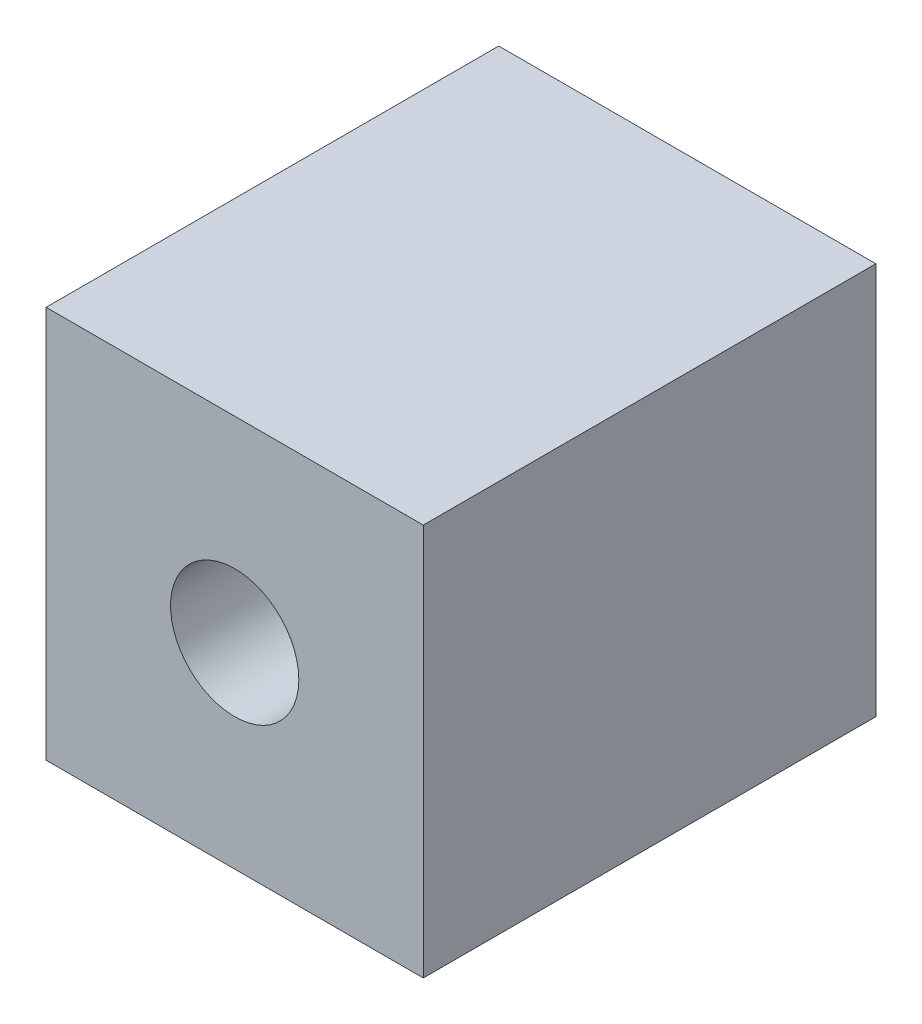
SolidWorks part; units mm, degrees
ref_plane "Plan de face" through (0, 0, 0) normal (0, 0, 1) x (1, 0, 0)
ref_plane "Plan de dessus" through (0, 0, 0) normal (0, 1, 0) x (1, 0, 0)
ref_plane "Plan de droite" through (0, 0, 0) normal (1, 0, 0) x (0, 0, -1)
sketch "Esquisse1" plane through (0, 0, 0) normal (0, 0, 1) x (1, 0, 0)
  line L1 (0, 0) -> (25, 0)
  line L2 (0, 0) -> (0, 26)
  line L3 (0, 26) -> (25, 26)
  line L4 (25, 0) -> (25, 26)
  dimension "D1" = 25
  dimension "D2" = 26
extrude "Extrusion1" add sketch "Esquisse1" along normal blind 30
hole_wizard "Trou taraudé M10x1.51" positions "Esquisse3" profile "Esquisse2" tap size "M10x1.5" standard "ISO"
sketch "Esquisse3" plane through (0, 0, 30) normal (0, 0, 1) x (1, 0, 0)
  line L0 (25, 0) -> (25, 26) construction
  line L1 (25, 26) -> (0, 26) construction
  point P0 (12.5, 13)
  dimension "D1" = 12.5
  dimension "D2" = 13
sketch "Esquisse2" plane through (12.5, 13, 30) normal (1, 0, 0) x (0, -1, 0)
  line L0 (0, 0) -> (0, 24.0537)
  line L1 (0, 24.0537) -> (4.25, 21.5)
  line L2 (4.25, 21.5) -> (4.25, 0)
  line L5 (4.25, 0) -> (0, 0)
  line L10 (0, 24.0537) -> (-4.25, 21.5) construction
  line L11 (0, -6.35) -> (0, 107.95) construction
  dimension "Diamètre du trou pour taraudage" = 8.5
  dimension "Profondeur du trou pour taraudage" = 21.5
  dimension "Angle de pointe" = 118
